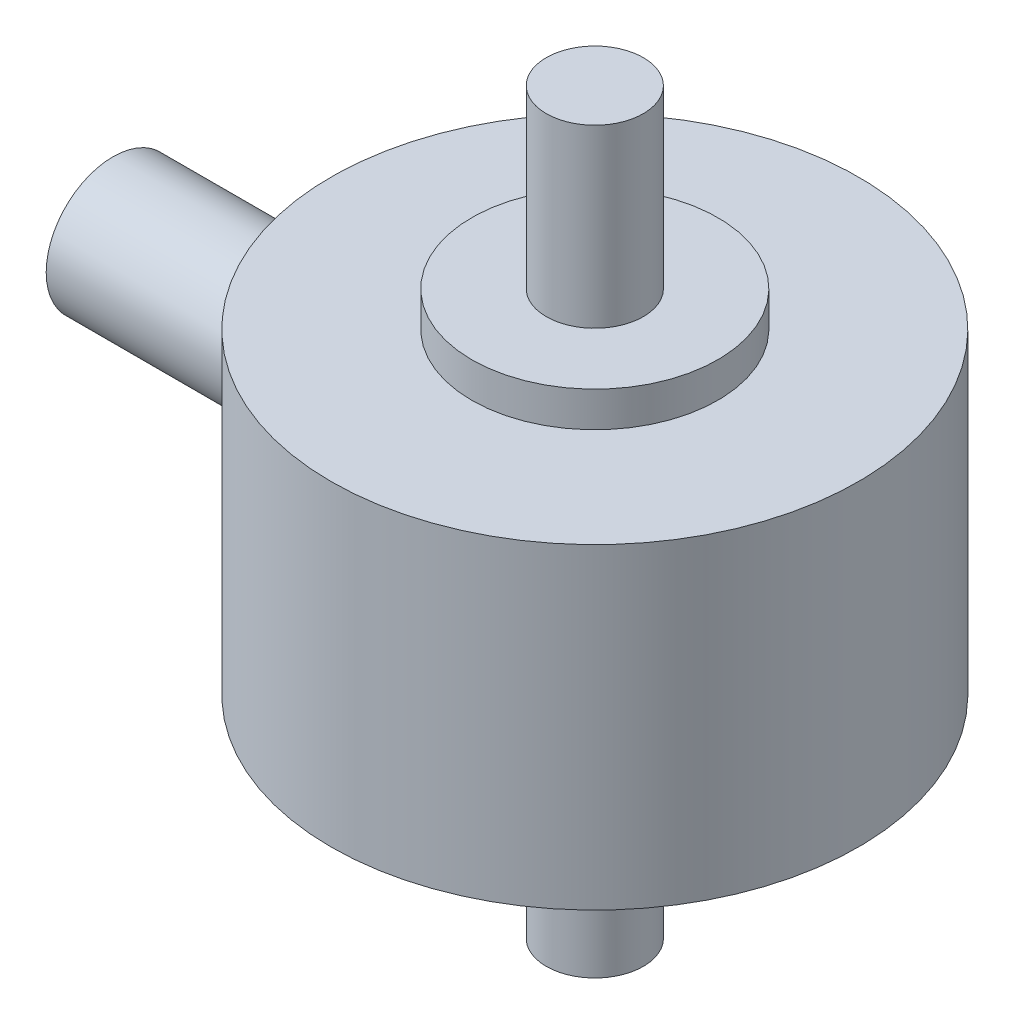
SolidWorks part; units mm, degrees
ref_plane "Front Plane" through (0, 0, 0) normal (0, 0, 1) x (1, 0, 0)
ref_plane "Top Plane" through (0, 0, 0) normal (0, 1, 0) x (1, 0, 0)
ref_plane "Right Plane" through (0, 0, 0) normal (1, 0, 0) x (0, 0, -1)
sketch "Sketch1" plane through (0, 0, 0) normal (0, 1, 0) x (1, 0, 0)
  circle A0 centre (0, 0) radius 9.525
  dimension "D1" = 19.05
extrude "Extrude1" add sketch "Sketch1" along normal blind 5.715
sketch "Sketch2" plane through (0, 5.715, 0) normal (0, 1, 0) x (-1, 0, 0)
  circle A0 centre (0, 0) radius 4.445
  dimension "D1" = 8.89
extrude "Extrude2" add sketch "Sketch2" along normal blind 1.27
sketch "Sketch3" plane through (0, 6.985, 0) normal (0, 1, 0) x (-1, 0, 0)
  circle A0 centre (0, 0) radius 1.7526
  dimension "D1" = 3.5052
extrude "Extrude3" add sketch "Sketch3" along normal blind 6.35
mirror "Mirror1" about plane through (0, 0, 0) normal (0, 1, 0) of "Extrude3", "Extrude2", "Extrude1"
ref_plane "Plane1" through (-9.525, 0, 0) normal (-1, 0, 0) x (0, 0, -1)
sketch "Sketch4" plane through (-9.525, 0, 0) normal (-1, 0, 0) x (0, 0, -1)
  circle A0 centre (0, 0) radius 2.413
  dimension "D1" = 4.826
extrude "Extrude4" add sketch "Sketch4" along normal blind 7.874 and the other way up to next
